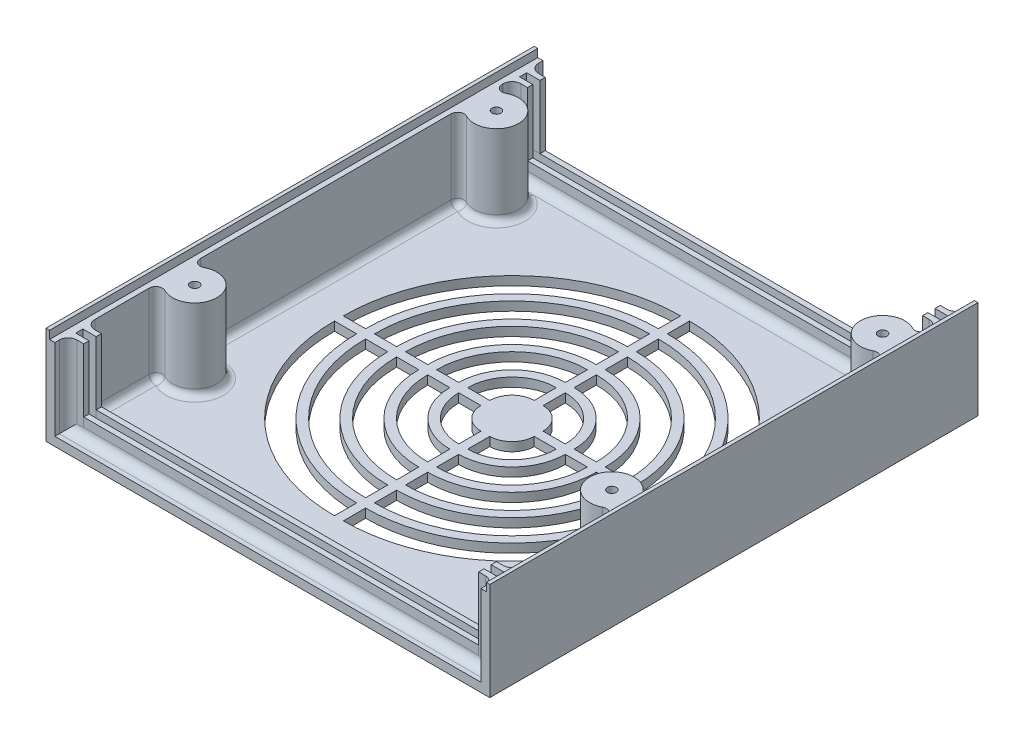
SolidWorks part; units mm, degrees
ref_plane "Спереди" through (0, 0, 0) normal (0, 0, 1) x (1, 0, 0)
ref_plane "Сверху" through (0, 0, 0) normal (0, 1, 0) x (1, 0, 0)
ref_plane "Справа" through (0, 0, 0) normal (1, 0, 0) x (0, 0, -1)
sketch "Эскиз1" plane through (0, 0, 0) normal (0, 1, 0) x (1, 0, 0)
  line L1 (-50, 55) -> (50, 55)
  line L2 (-50, 55) -> (-50, -55)
  line L3 (-50, -55) -> (50, -55)
  line L4 (50, 55) -> (50, -55)
  line L5 (-50, 55) -> (50, -55) construction
  line L6 (-50, -55) -> (50, 55) construction
  point P0 (0, 0)
  dimension "D1" = 110
  dimension "D2" = 100
extrude "Бобышка-Вытянуть1" add sketch "Эскиз1" along normal blind 22.1
sketch "Эскиз2" plane through (0, 22.1, 0) normal (0, 1, 0) x (1, 0, 0)
  line L0 (-48, 46) -> (-48, -46)
  line L1 (-46, -48) -> (-44.5, -48)
  line L2 (-44.5, -48) -> (-44.5, -49.2)
  line L3 (-44.5, -49.2) -> (-47.5, -49.2)
  line L4 (-47.5, -49.2) -> (-47.5, -50.8)
  line L5 (-47.5, -50.8) -> (-44.5, -50.8)
  line L6 (-44.5, -50.8) -> (-44.5, -52)
  line L7 (-44.5, -52) -> (-46, -52)
  line L8 (-48, -54) -> (-48, -55)
  line L9 (-50, -55) -> (50, -55) construction
  line L10 (0, 0) -> (-46.9941, 0) construction
  line L11 (-50, 55) -> (-50, -55) construction
  line L12 (0, 51.0945) -> (0, -54.7154) construction
  line L13 (-48, 54) -> (-48, 55)
  line L14 (-44.5, 52) -> (-46, 52)
  line L15 (-44.5, 50.8) -> (-44.5, 52)
  line L16 (-47.5, 50.8) -> (-44.5, 50.8)
  line L17 (-47.5, 49.2) -> (-47.5, 50.8)
  line L18 (-44.5, 49.2) -> (-47.5, 49.2)
  line L19 (-44.5, 48) -> (-44.5, 49.2)
  line L20 (-46, 48) -> (-44.5, 48)
  line L21 (46, 48) -> (44.5, 48)
  line L22 (44.5, 48) -> (44.5, 49.2)
  line L23 (44.5, 49.2) -> (47.5, 49.2)
  line L24 (47.5, 49.2) -> (47.5, 50.8)
  line L25 (47.5, 50.8) -> (44.5, 50.8)
  line L26 (44.5, 50.8) -> (44.5, 52)
  line L27 (44.5, 52) -> (46, 52)
  line L28 (48, 54) -> (48, 55)
  line L29 (48, -54) -> (48, -55)
  line L30 (44.5, -52) -> (46, -52)
  line L31 (44.5, -50.8) -> (44.5, -52)
  line L32 (47.5, -50.8) -> (44.5, -50.8)
  line L33 (47.5, -49.2) -> (47.5, -50.8)
  line L34 (44.5, -49.2) -> (47.5, -49.2)
  line L35 (44.5, -48) -> (44.5, -49.2)
  line L36 (46, -48) -> (44.5, -48)
  line L37 (48, 46) -> (48, -46)
  line L38 (-48, 55) -> (48, 55)
  line L39 (-48, -55) -> (48, -55)
  arc A0 (-48, -54) -> (-46, -52) centre (-46, -54) cw
  arc A1 (-48, -46) -> (-46, -48) centre (-46, -46) ccw
  arc A2 (-48, 46) -> (-46, 48) centre (-46, 46) cw
  arc A3 (-48, 54) -> (-46, 52) centre (-46, 54) ccw
  arc A4 (48, 54) -> (46, 52) centre (46, 54) cw
  arc A5 (48, 46) -> (46, 48) centre (46, 46) ccw
  arc A6 (48, -46) -> (46, -48) centre (46, -46) cw
  arc A7 (48, -54) -> (46, -52) centre (46, -54) ccw
  point P23 (-48, -52)
  point P39 (-48, 0)
  point P52 (48, 0)
  dimension "D6" = 2
  dimension "D7" = 2
  dimension "D1" = 2
  dimension "D2" = 1.2
  dimension "D3" = 1.2
  dimension "D4" = 1.6
  dimension "D5" = 3
  dimension "D8" = 2.5
  dimension "D9" = 3
extrude "Вырез-Вытянуть1" cut sketch "Эскиз2" against normal offset from surface (20.1 mm away) 2
sketch "Эскиз3" plane through (0, 0, 0) normal (1, 0, 0) x (0, 0, -1)
  line L0 (47.9992, 4) -> (47.9992, 6)
  line L1 (47.9992, 6) -> (49.1992, 6)
  line L2 (49.1992, 6) -> (49.1992, 3)
  line L3 (49.1992, 3) -> (50.7992, 3)
  line L4 (50.7992, 3) -> (50.7992, 6)
  line L5 (50.7992, 6) -> (51.9992, 6)
  line L6 (51.9992, 6) -> (51.9992, 4)
  line L7 (45.9992, 2) -> (53.9992, 2)
  line L8 (55, 22.1) -> (55, 0) construction
  line L9 (-55, 0) -> (55, 0) construction
  line L11 (0, 0) -> (0, 14.4735) construction
  line L12 (-45.9992, 2) -> (-53.9992, 2)
  line L13 (-51.9992, 6) -> (-51.9992, 4)
  line L14 (-50.7992, 6) -> (-51.9992, 6)
  line L15 (-50.7992, 3) -> (-50.7992, 6)
  line L16 (-49.1992, 3) -> (-50.7992, 3)
  line L17 (-49.1992, 6) -> (-49.1992, 3)
  line L18 (-47.9992, 6) -> (-49.1992, 6)
  line L19 (-47.9992, 4) -> (-47.9992, 6)
  arc A0 (53.9992, 2) -> (51.9992, 4) centre (53.9992, 4) cw
  arc A1 (45.9992, 2) -> (47.9992, 4) centre (45.9992, 4) ccw
  arc A2 (-45.9992, 2) -> (-47.9992, 4) centre (-45.9992, 4) cw
  arc A3 (-53.9992, 2) -> (-51.9992, 4) centre (-53.9992, 4) ccw
  dimension "D1" = 2
  dimension "D2" = 2
  dimension "D3" = 3
  dimension "D4" = 3
  dimension "D5" = 2
  dimension "D6" = 2
  dimension "D7" = 1.2
  dimension "D8" = 1.2
  dimension "D9" = 3
  dimension "D10" = 1.6
  dimension "D11" = 3.0008
  dimension "D12" = 1.6
  dimension "D13" = 2
  dimension "D14" = 2
extrude "Бобышка-Вытянуть2" add sketch "Эскиз3" along normal up to surface and the other way up to surface
sketch "Эскиз4" plane through (0, 0, 55) normal (0, 0, 1) x (1, 0, 0)
  line L0 (48, 22.1) -> (50, 22.1) construction
  line L1 (49.2, 22.1) -> (-49.2, 22.1)
  line L2 (49.2, 22.1) -> (49.2, 20.3)
  line L3 (49.2, 20.3) -> (-49.2, 20.3)
  line L4 (-49.2, 22.1) -> (-49.2, 20.3)
  line L6 (-50, 22.1) -> (-50, 0) construction
  line L7 (50, 22.1) -> (50, 0) construction
  dimension "D1" = 1.8
  dimension "D2" = 0.8
  dimension "D3" = 0.8
extrude "Вырез-Вытянуть2" cut sketch "Эскиз4" against normal through all
sketch "Эскиз5" plane through (0, 0, 0) normal (0, -1, 0) x (1, 0, 0)
  circle A0 centre (-43.5, 27.9984) radius 5
  circle A1 centre (-43.5, -40) radius 5
  circle A2 centre (43.5, -40) radius 5
  circle A3 centre (43.5, 20.9984) radius 5
  dimension "D1" = 10
extrude "Бобышка-Вытянуть3" add sketch "Эскиз5" against normal up to surface (20.3 mm away)
sketch "Эскиз6" plane through (0, 0, 0) normal (0, -1, 0) x (1, 0, 0)
  line L0 (0, 0) -> (0, -57.5055) construction
  line L1 (-63.421, -1) -> (-1, -1) construction
  line L2 (-63.421, 0) -> (0, 0) construction
  line L3 (-1, -1) -> (-1, -57.5055) construction
  line L4 (-1, -6) -> (-1, -11)
  line L5 (-6, -1) -> (-11, -1)
  line L6 (-6, 1) -> (-11, 1)
  line L7 (-1, 6) -> (-1, 11)
  line L8 (1, 6) -> (1, 11)
  line L9 (6, 1) -> (11, 1)
  line L10 (6, -1) -> (11, -1)
  line L11 (1, -6) -> (1, -11)
  arc A0 (-1, -11) -> (-11, -1) centre (-1, -1) cw
  arc A1 (-1, -6) -> (-6, -1) centre (-1, -1) cw
  arc A2 (-6, 1) -> (-1, 6) centre (-1, 1) cw
  arc A3 (-11, 1) -> (-1, 11) centre (-1, 1) cw
  arc A4 (1, 6) -> (6, 1) centre (1, 1) cw
  arc A5 (1, 11) -> (11, 1) centre (1, 1) cw
  arc A6 (6, -1) -> (1, -6) centre (1, -1) cw
  arc A7 (11, -1) -> (1, -11) centre (1, -1) cw
  point P29 (0, 0)
extrude "Вырез-Вытянуть3" cut sketch "Эскиз6" against normal up to surface (2 mm away)
other "Массив, управляемый размером1" parameters "D20"=17, "D21"=24, "D22"=31, "D23"=38
other "Экземпляр, управляемый размером1"
other "Экземпляр, управляемый размером2"
other "Экземпляр, управляемый размером3"
other "Экземпляр, управляемый размером4"
sketch "Эскиз7" plane through (0, 20.3, 0) normal (0, 1, 0) x (1, 0, 0)
  circle A0 centre (43.5, 40) radius 1
  circle A1 centre (43.5, -20.9984) radius 1
  circle A2 centre (-43.5, -27.9984) radius 1
  circle A3 centre (-43.5, 40) radius 1
  dimension "D1" = 2
extrude "Вырез-Вытянуть4" cut sketch "Эскиз7" against normal offset from surface (15.3 mm away) 5
fillet "Скругление1" radius 1.5 29 edges at (-46.0562, 5, -47.9992) (-46.6151, 3.3874, -47.9031) (-48, 2, -45.9996) (46.0562, 5, -47.9992) (46.4576, 3.5458, -47.9469) (48, 2, -45.9996) (46.0562, 5, 47.9992) (46.8884, 3.1132, 47.7919) (48, 2, 45.9996) (-46.0562, 5, 47.9992) (-46.4011, 3.6028, 47.9594) (-48, 2, 45.9996) (-48, 2, -44.0893) (48, 2, -44.0893) (48, 2, 34.5885) (38.5, 2, 20.9984) (48, 11.15, 23.1779) (48, 11.15, -37.8206) (48, 11.15, -42.1794) (48, 2, -9.5008) (38.5, 2, -40) (-38.5, 2, 27.9984) (-38.5, 2, -40) (-48, 11.15, -42.1794) (-48, 11.15, -37.8206) (-48, 11.15, 25.819) (-48, 11.15, 30.1779) (-48, 2, 38.0885) (-48, 2, -6.0008)
equation "\"D1\"= 20"
